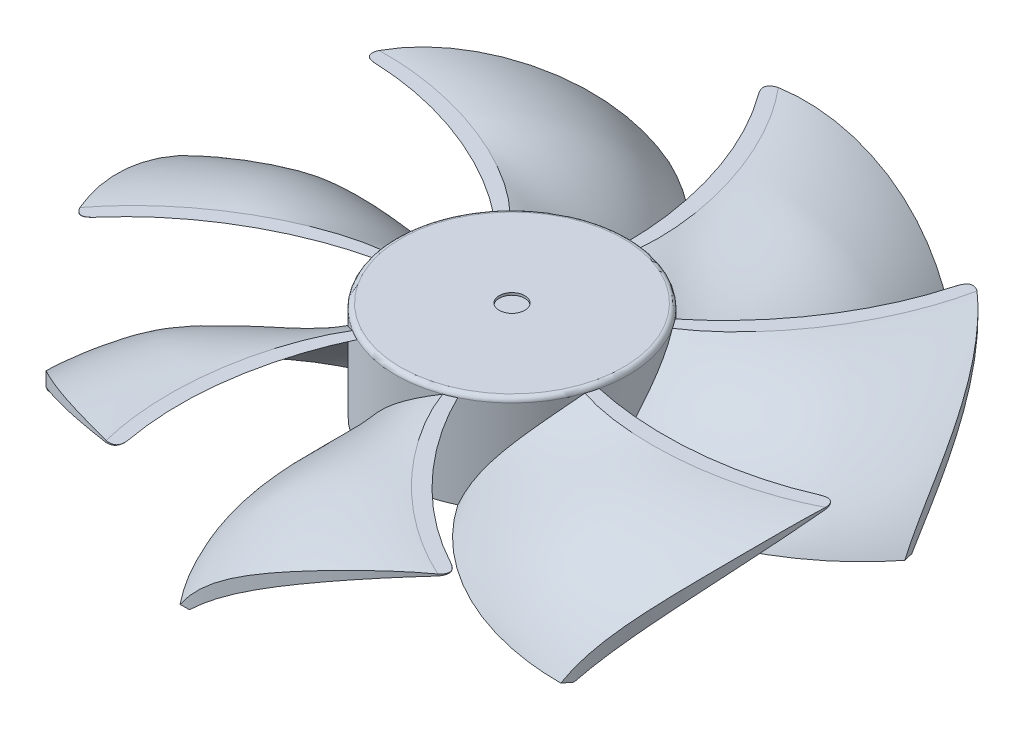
SolidWorks part; units mm, degrees
ref_plane "Front Plane" through (0, 0, 0) normal (0, 0, 1) x (1, 0, 0)
ref_plane "Top Plane" through (0, 0, 0) normal (0, 1, 0) x (1, 0, 0)
ref_plane "Right Plane" through (0, 0, 0) normal (1, 0, 0) x (0, 0, -1)
sketch "Sketch1" plane through (0, 0, 0) normal (0, 1, 0) x (1, 0, 0)
  circle A0 centre (0, 0) radius 25
  dimension "D1" = 50
ref_plane "Plane1" through (0, 20, 0) normal (0, 1, 0) x (1, 0, 0)
sketch "Sketch2" plane through (0, 20, 0) normal (0, 1, 0) x (1, 0, 0)
  circle A0 centre (0, 0) radius 25
  dimension "D1" = 50
sketch "Sketch3" plane through (0, 20, 0) normal (0, 1, 0) x (1, 0, 0)
  circle A0 centre (0, 0) radius 85
  dimension "D1" = 170
sketch "Sketch4" plane through (0, 0, 0) normal (0, 1, 0) x (1, 0, 0)
  circle A0 centre (0, 0) radius 85
  dimension "D1" = 170
sketch "Sketch5" plane through (0, 20, 0) normal (0, 1, 0) x (1, 0, 0)
  line L0 (0, 25) -> (0, 41.0711) construction
  line L1 (0, 41.0711) -> (-6.4351, 65.6758) construction
  line L2 (-6.4351, 65.6758) -> (-27.6159, 80.3888) construction
  line L3 (-27.6159, 80.3888) -> (-25.2399, 81.1662)
  line L4 (-25.2399, 81.1662) -> (-3.699, 67.5457) construction
  line L5 (-3.699, 67.5457) -> (4.0417, 40.3195) construction
  line L6 (4.0417, 40.3195) -> (2.5, 24.8747) construction
  line L7 (2.5, 24.8747) -> (0, 25)
  circle A1 centre (0, 0) radius 25 construction
  circle A2 centre (0, 0) radius 85 construction
  spline S0 degree 3 poles (0, 25) (0, 41.0711) (-6.4351, 65.6758) (-27.6159, 80.3888) knots 0 0 0 0 1 1 1 1
  spline S1 degree 3 poles (-25.2399, 81.1662) (-3.699, 67.5457) (4.0417, 40.3195) (2.5, 24.8747) knots 0 0 0 0 1 1 1 1
  dimension "D1" = 2.5
sketch "Sketch6" plane through (0, 0, 0) normal (0, 1, 0) x (1, 0, 0)
  line L0 (0, 25) -> (0, 0)
  line L1 (0, 0) -> (19.5435, 15.5902)
  circle A1 centre (0, 0) radius 25 construction
  dimension "D1" = 51.42
sketch "Sketch7" plane through (0, 0, 0) normal (0, 1, 0) x (1, 0, 0)
  line L0 (23.12, 81.7953) -> (21.62, 82.2045)
  line L1 (19.5435, 15.5902) -> (18.2347, 17.1025)
  circle A0 centre (0, 0) radius 85 construction
  circle A1 centre (0, 0) radius 25 construction
  spline S0 degree 3 poles (19.5435, 15.5902) (35.7988, 33.0028) (37.0882, 62.6779) (23.12, 81.7953) knots 0 0 0 0 1 1 1 1
  spline S1 degree 3 poles (21.62, 82.2045) (35.0677, 63.0919) (34.0079, 34.5857) (18.2347, 17.1025) knots 0 0 0 0 1 1 1 1
  dimension "D1" = 1.5
  dimension "D2" = 2
sketch3d "3DSketch1"
  spline S0 degree 3 poles (-1.9371, 20, -51.7991) (11.9293, 20.3367, -52.2583) (26.8936, 12.9903, -54.017) (32.7339, 0, -51.7138) knots 0 0 0 0 1 1 1 1
  spline S1 degree 3 poles (-25.2399, 20, -81.1662) (-3.699, 20, -67.5457) (4.0417, 20, -40.3195) (2.5, 20, -24.8747) knots 0 0 0 0 1 1 1 1 construction
  spline S2 degree 3 poles (19.5435, 0, -15.5902) (35.7988, 0, -33.0028) (37.0882, 0, -62.6779) (23.12, 0, -81.7953) knots 0 0 0 0 1 1 1 1 construction
sketch3d "3DSketch3"
  spline S0 degree 2 poles (2.6566, 20, -30.6353) (15.8117, 14.4556, -23.2554) (22.4612, 0, -19.0527) knots 0 0 0 1 1 1
  spline S1 degree 3 poles (-25.2399, 20, -81.1662) (-3.699, 20, -67.5457) (4.0417, 20, -40.3195) (2.5, 20, -24.8747) knots 0 0 0 0 1 1 1 1 construction
  spline S2 degree 3 poles (19.5435, 0, -15.5902) (35.7988, 0, -33.0028) (37.0882, 0, -62.6779) (23.12, 0, -81.7953) knots 0 0 0 0 1 1 1 1 construction
loft "Loft1" add profiles "Sketch5", "Sketch7"
sketch "Sketch11" plane through (0, 0, 0) normal (0, 1, 0) x (1, 0, 0)
  line L0 (-21.9008, 75.8806) -> (-27.1236, 74.5868)
  line L1 (-27.1236, 74.5868) -> (-31.6285, 86.6198)
  line L2 (-31.6285, 86.6198) -> (32.9659, 88.3664)
  line L3 (32.9659, 88.3664) -> (30.5349, 75.8806)
  arc A0 (30.5349, 75.8806) -> (-21.8422, 78.8236) centre (0, 0) ccw
  spline S0 degree 2 poles (-21.8422, 78.8236) (-24.1179, 77.8787) (-21.9008, 75.8806) knots 0 0 0 1 1 1
  spline S1 degree 3 poles (2.5, 24.8747) (4.0417, 40.3195) (-3.699, 67.5457) (-25.2399, 81.1662) knots 0 0 0 0 1 1 1 1 construction
  spline S2 degree 3 poles (-27.6159, 80.3888) (-6.4351, 65.6758) (0, 41.0711) (0, 25) knots 0 0 0 0 1 1 1 1 construction
extrude "Cut-Extrude1" cut sketch "Sketch11" along normal blind 30
extrude "Boss-Extrude1" add sketch "Sketch1" along normal blind 21 contours A0
fillet "Fillet1" radius 1 1 edges at (0, 21, 25)
pattern_circular "CirPattern1" count 7 over 360
sketch "Sketch12" plane through (0, 21, 0) normal (0, 1, 0) x (1, 0, 0)
  circle A0 centre (0, 0) radius 2.7505
extrude "Cut-Extrude2" cut sketch "Sketch12" against normal blind 0.5
sketch "Sketch13" plane through (0, 0, 0) normal (0, -1, 0) x (1, 0, 0)
  circle A0 centre (0, 0) radius 22.5
extrude "Cut-Extrude3" cut sketch "Sketch13" against normal blind 19
sketch "Sketch14" plane through (0, 19, 0) normal (0, -1, 0) x (1, 0, 0)
  circle A0 centre (0, 0) radius 3.9009
extrude "Boss-Extrude2" add sketch "Sketch14" along normal blind 4
sketch "Sketch15" plane through (0, 15, 0) normal (0, -1, 0) x (1, 0, 0)
  circle A0 centre (0, 0) radius 1.8184
extrude "Boss-Extrude3" add sketch "Sketch15" along normal blind 18
chamfer "Chamfer1" distance 0.7 angle 45 1 edges at (0, -3, -1.8184)
sketch "Sketch16" plane through (0, 0, 0) normal (0, 0, 1) x (1, 0, 0)
  line L0 (-1.8184, -1.9975) -> (-1.584, -1.9975)
  line L1 (-1.8184, 15) -> (-1.8184, -2.3) construction
  line L2 (-1.584, -1.9975) -> (-1.584, -1.7021)
  line L3 (-1.584, -1.7021) -> (-1.8184, -1.7021)
  line L4 (-1.8184, -1.7021) -> (-2.102, -1.4185)
  line L5 (-2.102, -1.4185) -> (-2.102, -2.3)
  line L6 (-2.102, -2.3) -> (-1.8184, -1.9975)
sketch "Sketch17" plane through (0, 0, 0) normal (0, 0, 1) x (1, 0, 0)
  line L0 (0, -5.2251) -> (0, 11.187) construction
revolve "Cut-Revolve2" cut sketch "Sketch16" angle 360 about L0
sketch "Sketch19" plane through (0, 21, 0) normal (0, 1, 0) x (1, 0, 0)
  circle A0 centre (0, 0) radius 71
extrude "Cut-Extrude-Thin1" cut sketch "Sketch19" against normal blind 60 thin
sketch "Sketch20" plane through (0, 21, 0) normal (0, 1, 0) x (1, 0, 0)
  line L0 (-62.4323, 33.8114) -> (-64.4557, 35.0937)
  line L1 (-64.4557, 35.0937) -> (-66.8862, 29.7987)
  line L2 (-66.8862, 29.7987) -> (-60.1547, 29.7987)
  line L3 (-60.1547, 29.7987) -> (-60.1547, 30.9814)
  line L4 (-14.2083, 65.61) -> (-13.2836, 66.3474)
  line L5 (-12.4911, 69.8926) -> (-12.7501, 72.274)
  line L6 (-12.7501, 72.274) -> (-18.4053, 70.8729)
  line L7 (-18.4053, 70.8729) -> (-14.2083, 65.61)
  line L8 (42.4372, 52.0156) -> (43.5903, 51.7524)
  line L9 (46.8562, 53.3432) -> (48.5565, 55.0305)
  line L10 (48.5565, 55.0305) -> (43.9351, 58.5783)
  line L11 (43.9351, 58.5783) -> (42.4372, 52.0156)
  line L12 (67.1266, -0.7476) -> (67.6398, -1.8132)
  line L13 (70.9198, -3.3747) -> (73.2991, -3.6521)
  line L14 (73.2991, -3.6521) -> (73.1915, 2.1731)
  line L15 (73.1915, 2.1731) -> (67.1266, -0.7476)
  line L16 (41.2683, -52.9478) -> (40.7551, -54.0134)
  line L17 (41.5793, -57.5514) -> (42.846, -59.5846)
  line L18 (42.846, -59.5846) -> (47.3332, -55.8685)
  line L19 (47.3332, -55.8685) -> (41.2683, -52.9478)
  line L20 (-15.6659, -65.2773) -> (-16.819, -65.5405)
  line L21 (-19.0712, -68.3907) -> (-19.8711, -70.6487)
  line L22 (-19.8711, -70.6487) -> (-14.168, -71.84)
  line L23 (-14.168, -71.84) -> (-15.6659, -65.2773)
  line L24 (-60.8034, -28.4516) -> (-61.7281, -27.7142)
  line L25 (-65.3607, -27.7305) -> (-67.6248, -28.5129)
  line L26 (-67.6248, -28.5129) -> (-65.0004, -33.7145)
  line L27 (-65.0004, -33.7145) -> (-60.8034, -28.4516)
  spline S0 degree 2 poles (-62.4323, 33.8114) (-63.5968, 31.0652) (-60.1547, 30.9814) knots 0 0 0 1 1 1
  spline S1 degree 3 poles (-63.8596, 31.0316) (-45.5225, 31.3337) (-29.3089, 23.373) (-19.5458, 15.5872) knots 0.222985 0.222985 0.222985 0.222985 1 1 1 1 construction
  spline S2 degree 2 poles (-12.4911, 69.8926) (-15.3641, 69.0908) (-13.2836, 66.3474) knots 0 0 0 1 1 1
  spline S3 degree 2 poles (46.8562, 53.3432) (44.438, 55.0896) (43.5903, 51.7524) knots 0 0 0 1 1 1
  spline S4 degree 2 poles (70.9198, -3.3747) (70.7774, -0.3952) (67.6398, -1.8132) knots 0 0 0 1 1 1
  spline S5 degree 2 poles (41.5793, -57.5514) (43.82, -55.5824) (40.7551, -54.0134) knots 0 0 0 1 1 1
  spline S6 degree 2 poles (-19.0712, -68.3907) (-16.1348, -68.9149) (-16.819, -65.5405) knots 0 0 0 1 1 1
  spline S7 degree 2 poles (-65.3607, -27.7305) (-63.9397, -30.3531) (-61.7281, -27.7142) knots 0 0 0 1 1 1
  point P48 (0, 0)
  dimension "D1" = 7
extrude "Cut-Extrude4" cut sketch "Sketch20" against normal blind 10
scale "Scale1" scale about centroid uniform scaling yes scale factor 0.788
